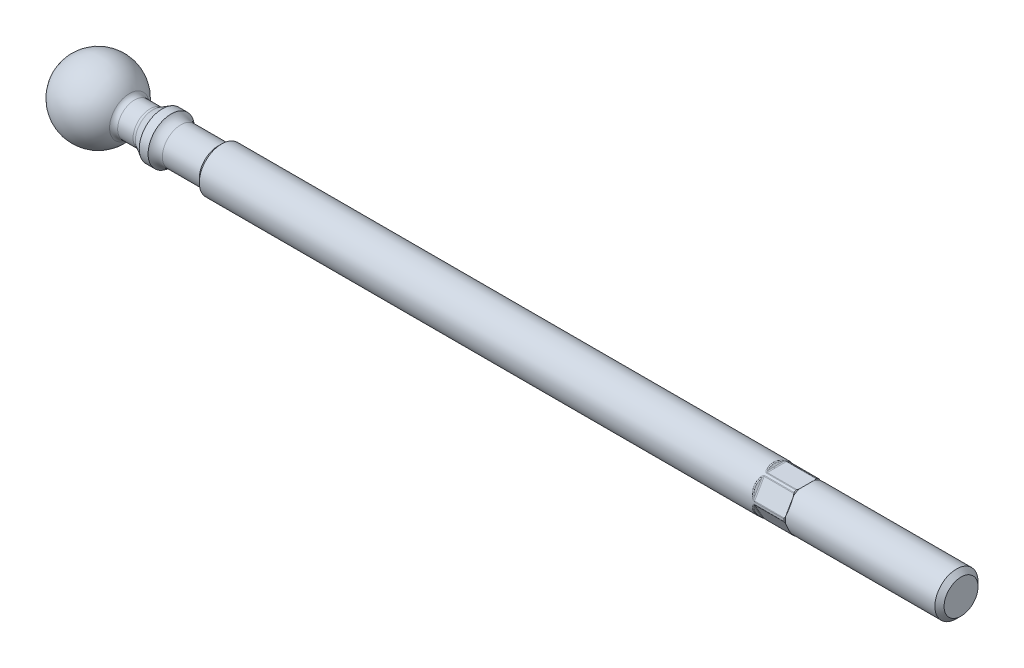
SolidWorks part; units mm, degrees
ref_plane "Plan1" through (0, 0, 0) normal (0, 0, 1) x (1, 0, 0)
ref_plane "Plan2" through (0, 0, 0) normal (0, 1, 0) x (1, 0, 0)
ref_plane "Plan3" through (0, 0, 0) normal (1, 0, 0) x (0, 0, -1)
sketch "Esquisse1" plane through (0, 0, 0) normal (0, 0, 1) x (1, 0, 0)
  line L0 (0, 0) -> (104, 0) construction
  line L1 (-10, 0) -> (280, 0)
  line L2 (-10, 0) -> (-10, 6.6332)
  line L3 (11.8216, 5.5) -> (16.8216, 5.5)
  line L4 (17.8216, 5.7679) -> (20.8216, 7.5)
  line L5 (20.8216, 7.5) -> (23.6991, 7.5)
  line L7 (26.8216, 6) -> (38.8216, 6)
  line L8 (38.8216, 6) -> (40.0716, 7.25)
  line L9 (40.0716, 7.25) -> (229.75, 7.25)
  line L10 (229.75, 7.25) -> (230, 7)
  line L11 (230, 7) -> (278.5, 7)
  line L12 (278.5, 7) -> (280, 5.5)
  line L13 (280, 5.5) -> (280, 0)
  arc A0 (10.1328, 6.4286) -> (-10, 6.6332) centre (0, 0) ccw
  arc A1 (11.8216, 5.5) -> (10.1328, 6.4286) centre (11.8216, 7.5) cw
  arc A2 (17.8216, 5.7679) -> (16.8216, 5.5) centre (16.8216, 7.5) cw
  arc A3 (23.6991, 7.5) -> (26.8216, 6) centre (26.8216, 10) ccw
  dimension "D1" = 12
  dimension "D3" = 2
  dimension "D4" = 4
  dimension "D2" = 10
  dimension "D5" = 7.5
  dimension "D6" = 6
  dimension "D7" = 5.5
  dimension "D8" = 30
  dimension "D9" = 5
  dimension "D10" = 12
  dimension "D11" = 45
  dimension "D12" = 7.25
  dimension "D13" = 7
  dimension "D14" = 10
  dimension "D15" = 45
  dimension "D16" = 1.5
  dimension "D17" = 45
  dimension "D18" = 280
  dimension "D19" = 50
revolve "Base-Révolution" add sketch "Esquisse1" angle 360 about L0
sketch "Esquisse2" plane through (0, 0, 0) normal (0, 0, 1) x (1, 0, 0)
  line L0 (220, 6.5) -> (230, 6.5)
  line L1 (230, 6.5) -> (233, 9.5)
  line L2 (233, 9.5) -> (217, 9.5)
  line L3 (217, 9.5) -> (220, 6.5)
  line L4 (0, 0) -> (104, 0) construction
  line L5 (230, 7) -> (230, -7) construction
  line L6 (206, 0) -> (239, 0) construction
  line L7 (217, -9.5) -> (220, -6.5)
  line L8 (233, -9.5) -> (217, -9.5)
  line L9 (230, -6.5) -> (233, -9.5)
  line L10 (220, -6.5) -> (230, -6.5)
  dimension "D1" = 6.5
  dimension "D2" = 3
  dimension "D3" = 45
  dimension "D4" = 10
extrude "Enlèv. mat.-Extru.1" cut sketch "Esquisse2" against normal mid plane 20
fillet "Congé2" radius 0.5
pattern_circular "Répétition circulaire1" count 3 every 60 about axis through (0, 0, 0) along (1, 0, 0)
